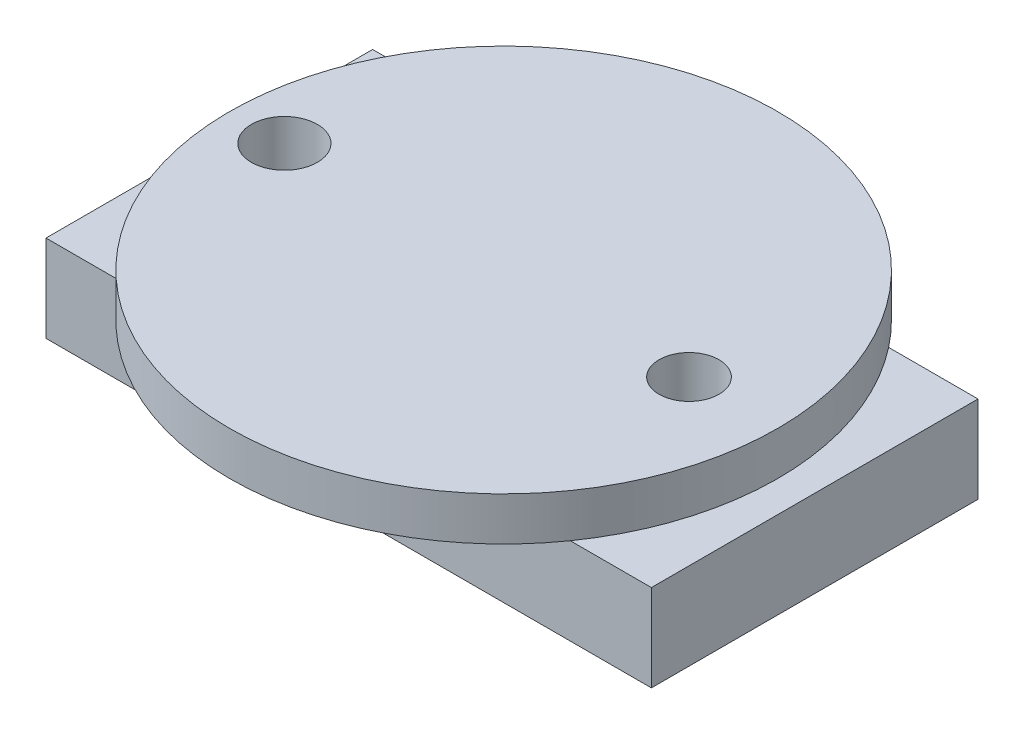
SolidWorks part; units mm, degrees
other "Markup1"
sketch "Sketch4" plane through (28.9924, 25.4, 80.1371) normal (0.079, 0.551, 0.8307) x (0.9966, -0.0637, -0.0525)
ref_plane "Front Plane" through (0, 0, 0) normal (0, 0, 1) x (1, 0, 0)
ref_plane "Top Plane" through (0, 0, 0) normal (0, 1, 0) x (1, 0, 0)
ref_plane "Right Plane" through (0, 0, 0) normal (1, 0, 0) x (0, 0, -1)
sketch "Sketch2" plane through (0, 0, 0) normal (0, 1, 0) x (1, 0, 0)
  line L0 (-193.4118, 0) -> (197.519, 0) construction
  line L5 (-29.1627, 2.5349) -> (-14.477, 2.5349)
  line L6 (-69.5171, 17.9984) -> (-90.3148, 18.0243)
  line L7 (-115.0431, 2.5349) -> (-102.4899, 2.5349)
  line L8 (-115.0431, -2.5349) -> (-102.4899, -2.5349)
  line L9 (-90.3148, 18.0243) -> (-100.7361, 0.0259)
  line L10 (-60.698, 8.27) -> (-67.9308, 20.7977)
  line L11 (-67.9308, 20.7977) -> (-91.9459, 20.7977)
  line L12 (-91.9459, 20.7977) -> (-102.4899, 2.5349)
  line L13 (-102.4899, -2.5349) -> (-91.9459, -20.7977)
  line L14 (-91.9459, -20.7977) -> (-67.9308, -20.7977)
  line L15 (-67.9308, -20.7977) -> (-60.698, -8.27)
  line L16 (-100.7361, 0.0259) -> (-90.3596, -17.9984)
  line L17 (-90.3596, -17.9984) -> (-69.5619, -18.0243)
  line L18 (-69.5619, -18.0243) -> (-62.0716, -5.0879)
  line L19 (-59.1407, -0.0259) -> (-59.1556, 0)
  line L20 (-29.1627, -2.5349) -> (-14.477, -2.5349)
  line L21 (-62.0762, 5.0733) -> (-69.5171, 17.9984)
  line L23 (-147.9067, 49.3581) -> (28.9924, 49.3581)
  line L24 (-147.9067, 49.3581) -> (-147.9067, -46.0864)
  line L25 (-147.9067, -46.0864) -> (28.9924, -46.0864)
  line L26 (28.9924, 49.3581) -> (28.9924, -46.0864)
  arc A0 (-115.0431, 2.5349) -> (-115.0431, -2.5349) centre (-124.3362, 0) ccw
  circle A1 centre (-79.9384, 0) radius 20.7977 construction
  circle A2 centre (-79.9384, 0) radius 18.0113 construction
  arc A3 (-62.0762, 5.0733) -> (-62.0716, -5.0879) centre (-45.9128, 0) ccw
  arc A5 (-60.7867, -8.1093) -> (-29.1627, -2.5349) centre (-45.9128, 0) ccw
  arc A6 (-29.1627, 2.5349) -> (-60.7867, 8.1093) centre (-45.9128, 0) ccw
  arc A7 (-14.477, -2.5349) -> (-14.477, 2.5349) centre (-6.0912, 0) ccw
  point P0 (0, 0)
extrude "Boss-Extrude5" add sketch "Sketch2" along normal blind 12.7 contours A3 L21 L6 L9 L16 L17 L18 | L26 L23 L24 L25 A7 L20 A5 L15 L14 L13 L8 A0 L7 L12 L11 L10 A6 L5
sketch "Sketch3" plane through (0, 12.7, 0) normal (0, 1, 0) x (1, 0, 0)
  circle A0 centre (-124.3362, 0) radius 9.6326
  circle A1 centre (-6.0912, 0) radius 8.7606
  circle A2 centre (-60.2555, 0) radius 80.1371
extrude "Boss-Extrude7" add sketch "Sketch3" along normal blind 12.7 contours A0 | A1 | A2
sketch "Sketch6" plane through (0, 0, 0) normal (0, -1, 0) x (-1, 0, 0)
  line L1 (-28.9924, 49.3581) -> (147.9067, 49.3581)
  line L2 (-28.9924, 49.3581) -> (-28.9924, -46.0864)
  line L3 (-28.9924, -46.0864) -> (147.9067, -46.0864)
  line L4 (147.9067, 49.3581) -> (147.9067, -46.0864)
sketch "Sketch7" plane through (0, 0, 0) normal (0, -1, 0) x (-1, 0, 0)
  line L1 (147.9067, -46.0864) -> (-28.9924, -46.0864)
  line L2 (147.9067, -46.0864) -> (147.9067, 49.3581)
  line L3 (147.9067, 49.3581) -> (-28.9924, 49.3581)
  line L4 (-28.9924, -46.0864) -> (-28.9924, 49.3581)
extrude "Boss-Extrude9" add sketch "Sketch7" along normal blind 12.7
